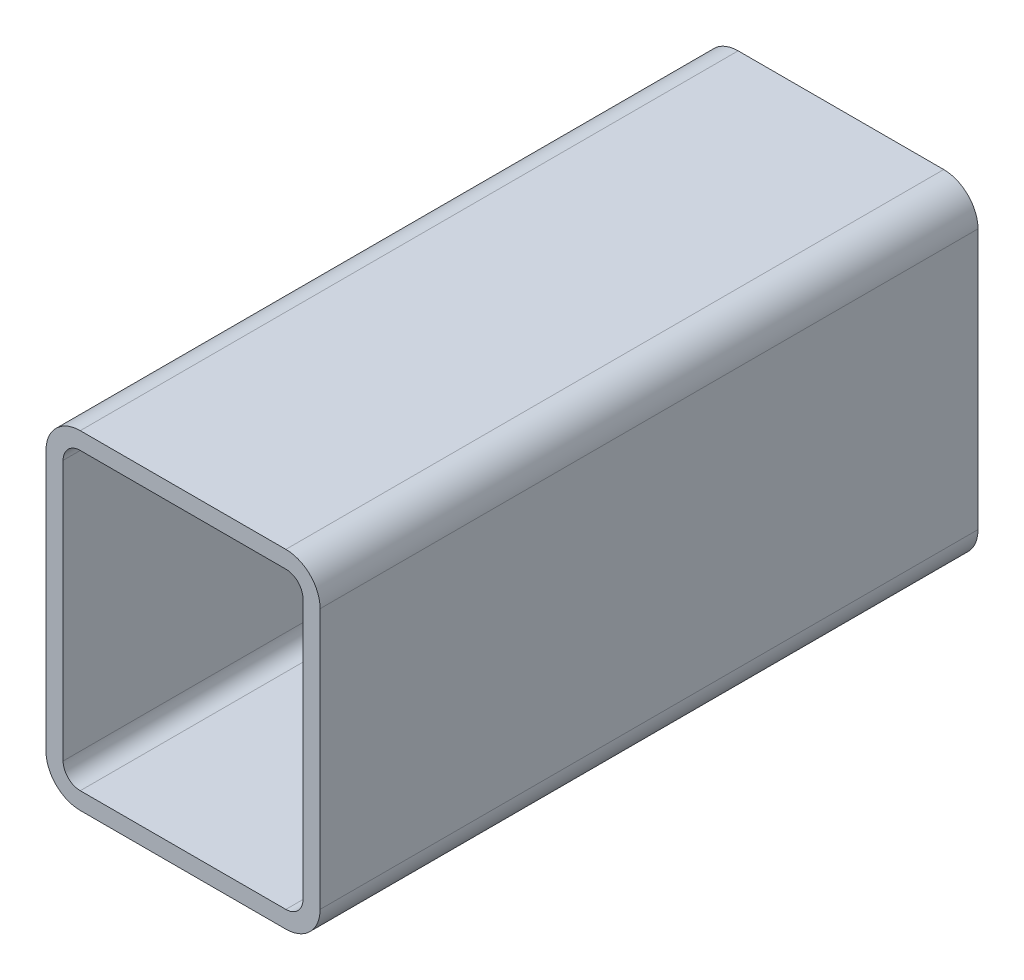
SolidWorks part; units mm, degrees
ref_plane "Front Plane" through (0, 0, 0) normal (0, 0, 1) x (1, 0, 0)
ref_plane "Top Plane" through (0, 0, 0) normal (0, 1, 0) x (1, 0, 0)
ref_plane "Right Plane" through (0, 0, 0) normal (1, 0, 0) x (0, 0, -1)
sketch "Sketch1" plane through (0, 0, 0) normal (0, 0, 1) x (1, 0, 0)
sketch_block_instance "HSS6x5x0.3125-1"
sketch_block "HSS6x5x0.3125"
extrude "Boss-Extrude1" add sketch "Sketch1" along normal blind 304.8
